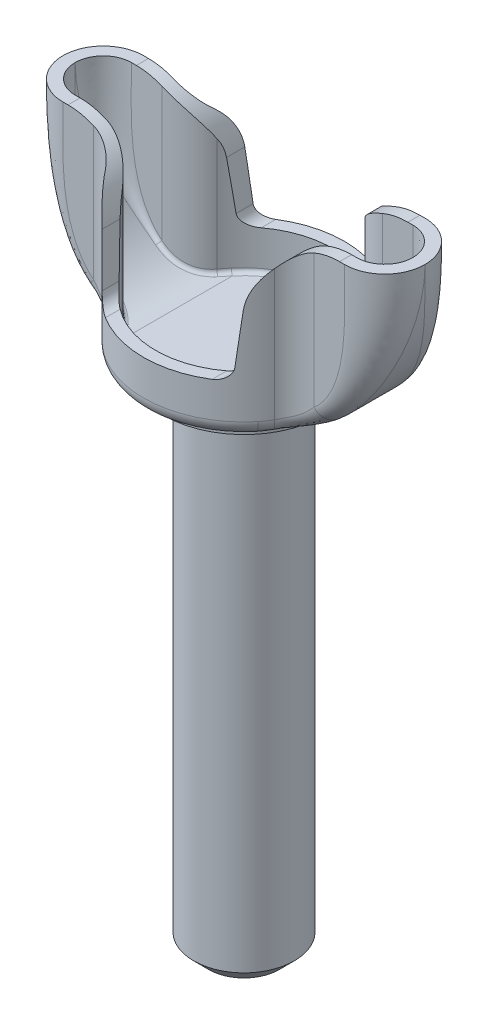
SolidWorks part; units mm, degrees
ref_plane "Front Plane" through (0, 0, 0) normal (0, 0, 1) x (1, 0, 0)
ref_plane "Top Plane" through (0, 0, 0) normal (0, 1, 0) x (1, 0, 0)
ref_plane "Right Plane" through (0, 0, 0) normal (1, 0, 0) x (0, 0, -1)
sketch "ReferSke" plane through (0, 0, 0) normal (0, 0, 1) x (1, 0, 0)
  line L0 (0, 0) -> (0, -18) construction
  dimension "Head_height" = 18
sketch "HeadSke" plane through (0, 0, 0) normal (0, 1, 0) x (1, 0, 0)
  line L0 (0, 73.6257) -> (0, -72.8166) construction
  line L1 (18, -4) -> (9.1652, -4)
  line L2 (-18, -4) -> (-9.1652, -4)
  line L3 (0, 0) -> (40.2198, 0) construction
  line L4 (-18, 4) -> (-9.1652, 4)
  line L5 (18, 4) -> (9.1652, 4)
  line L6 (-18, 4) -> (-18, -4)
  line L7 (18, -4) -> (18, 4)
  arc A0 (-9.1652, -4) -> (9.1652, -4) centre (0, 0) ccw
  arc A2 (9.1652, 4) -> (-9.1652, 4) centre (0, 0) ccw
  dimension "Mid_width" = 20
  dimension "Head_width" = 36
  dimension "Wing_width" = 8
extrude "Head" add sketch "HeadSke" against normal blind 17.1
sketch "CutHeadSke" plane through (0, 0, 0) normal (0, 0, 1) x (1, 0, 0)
  line L0 (0, 0) -> (0, -18.7628) construction
  line L1 (-18, 0) -> (-13.506, 0)
  line L2 (-7.0308, -5.9335) -> (-6.5, -12)
  line L3 (-6.5, -12) -> (6.5, -12)
  line L4 (6.5, -17.1) -> (-6.5, -17.1)
  line L5 (-9.1652, -17.1) -> (9.1652, -17.1) construction
  line L6 (-18, 0) -> (-18, 13.115) construction
  line L8 (-18, -17.1) -> (-18, 0) construction
  line L10 (18, 0) -> (13.506, 0)
  line L11 (7.0308, -5.9335) -> (6.5, -12)
  line L12 (-18, -17.1) -> (-18, 0) construction
  line L13 (-25, 3) -> (25, 3)
  line L14 (-25, 3) -> (-25, -22)
  line L15 (-25, -22) -> (25, -22)
  line L16 (25, 3) -> (25, -22)
  line L17 (-18, 0) -> (-9.1652, 0) construction
  line L18 (-18, 0) -> (-9.1652, 0) construction
  arc A1 (-13.506, 0) -> (-7.0308, -5.9335) centre (-13.506, -6.5) cw
  arc A3 (13.506, 0) -> (7.0308, -5.9335) centre (13.506, -6.5) ccw
  ellipse E0 centre (6.5, 0) end of major axis (6.5, -17.1) minor radius 11.5 (6.5, -17.1) -> (18, 0) ccw
  ellipse E1 centre (-6.5, 0) end of major axis (-6.5, -17.1) minor radius 11.5 (-6.5, -17.1) -> (-18, 0) cw
  point P18 (0, -17.1)
  point P24 (0, -12)
  dimension "D3" = 6.5
  dimension "D4" = 50
  dimension "D1" = 3
  dimension "Base_width" = 13
  dimension "D2" = 25
  dimension "Wing_ang" = 5
  dimension "Cut_height" = 6
extrude "CutHead" cut sketch "CutHeadSke" against normal mid plane 20
fillet "Fillet1" radius 3 4 edges at (-9.1652, -9.1482, 4) (9.1652, -9.1482, 4) (-9.1652, -9.1482, -4) (9.1652, -9.1482, -4)
fillet "WingFillet" radius 1.6 4 edges at (16.078, -9.4643, 4) (16.078, -9.4643, -4) (-16.078, -9.4643, -4) (-16.078, -9.4643, 4)
shell "Shell"
fillet "Fillet2" radius 1.3 4 edges at (6.5, -12, 6.7657) (6.5, -12, -6.7657) (-6.5, -12, -6.7657) (-6.5, -12, 6.7657)
sketch "BodySke" plane through (0, 0, 0) normal (0, 0, 1) x (1, 0, 0)
  line L0 (0, -15.9) -> (-8, -15.9)
  line L1 (-8, -15.9) -> (-8, -18)
  line L2 (-8, -18) -> (-5, -18)
  line L3 (-5, -18) -> (-5, -68)
  line L4 (-5, -68) -> (0, -68)
  line L5 (0, -68) -> (0, -15.9)
  line L7 (0, 0) -> (0, -86.7611) construction
  line L8 (6.5, -15.9) -> (-6.5, -15.9) construction
  line L9 (-4.172, -48.3988) -> (-4.172, -77.8075) construction
  line L10 (2.3461, -66.5) -> (-10.2468, -66.5) construction
  dimension "Base_Diameter" = 16
  dimension "Diameter" = 10
  dimension "Length" = 50
  dimension "Minor_dia" = 8.344
  dimension "Advance" = 1.5
revolve "BaseBody" add sketch "BodySke" angle 360 about L7
sketch "ChamferedEndSke" plane through (0, 0, 0) normal (0, 0, 1) x (1, 0, 0)
  line L0 (-3.5, -68) -> (-5, -68)
  line L1 (-5, -68) -> (-5, -66.5)
  line L2 (-5, -66.5) -> (-3.5, -68)
  line L5 (0, 0) -> (0, -120.2191) construction
  dimension "Ang" = 45
  dimension "Chamfer_width" = 1.5
revolve "ChamferedEnd" cut sketch "ChamferedEndSke" angle 360 about L5
sketch "CutEndSke" plane through (0, -68, 0) normal (0, -1, 0) x (1, 0, 0)
  circle A0 centre (0, 0) radius 5 construction
  circle A1 centre (0, 0) radius 5
extrude "CutEnd" [suppressed] cut sketch "CutEndSke" against normal blind 1.5
dome "RoundedEnd" [suppressed] faces to dome 1 distance 1.5 parameters "D1"=1.5
sketch "ThdSchSke" plane through (0, 0, 0) normal (0, 0, 1) x (1, 0, 0)
  line L1 (24.1558, -68) -> (-21.9887, -68) construction
  line L2 (5, -67.203) -> (4.172, -66.725)
  line L3 (4.172, -66.725) -> (5, -66.247)
  line L4 (5, -66.247) -> (5.9561, -66.247)
  line L5 (5.9561, -66.247) -> (5.9561, -67.203)
  line L6 (5.9561, -67.203) -> (5, -67.203)
  line L7 (0, 0) -> (0, -81.9048) construction
  line L8 (-8, -18) -> (8, -18) construction
  dimension "D1" = 8.344
  dimension "D2" = 10
  dimension "D3" = 1.275
  dimension "Length" = 50
revolve "ThreadSchematic" [suppressed] cut sketch "ThdSchSke" angle 360 about L7
pattern_linear "ThdSchPat" [suppressed] count 32 along (0, -1, 0)
equation "\"Height@Head\" = \"Head_height@ReferSke\"*0.95"
equation "\"D3@CutHeadSke\" = \"Base_width@CutHeadSke\"/2"
equation "\"D1@CutHead\" = \"Mid_width@HeadSke\""
equation "\"D1@Fillet1\" = \"Mid_width@HeadSke\"*0.15"
equation "\"D3@WingFillet\" = \"Wing_width@HeadSke\"/2"
equation "\"D0@WingFillet\" = \"Wing_width@HeadSke\"/2"
equation "\"D7@WingFillet\" = \"Wing_width@HeadSke\"/2"
equation "\"D4@WingFillet\" = \"Wing_width@HeadSke\"/2"
equation "\"D5@WingFillet\" = \"Wing_width@HeadSke\"/5"
equation "\"D2@WingFillet\" = \"Wing_width@HeadSke\"/5"
equation "\"D6@WingFillet\" = \"Wing_width@HeadSke\"/5"
equation "\"D1@WingFillet\" = \"Wing_width@HeadSke\"/5"
equation "\"D1@Fillet2\" = \"Base_width@CutHeadSke\"/10"
equation "\"Thread_minor@ThreadCosmetic\" = \"Minor_dia@BodySke\""
equation "\"D1@CutEnd\" = \"Chamfer_width@ChamferedEndSke\""
equation "\"D1@RoundedEnd\" = \"Chamfer_width@ChamferedEndSke\""
equation "\"Length@ThdSchSke\" = \"Length@BodySke\""
equation "\"D3@ThdSchSke\" = \"Advance@BodySke\" * 0.85"
equation "\"D2@ThdSchSke\" = \"Diameter@BodySke\""
equation "\"D1@ThdSchSke\" = \"Minor_dia@BodySke\""
equation "\"Advance@ThdSchPat\" = \"Advance@BodySke\""
equation "\"D1@ThdSchPat\" =  int( \"Length@BodySke\" / \"Advance@BodySke\" ) -1"
